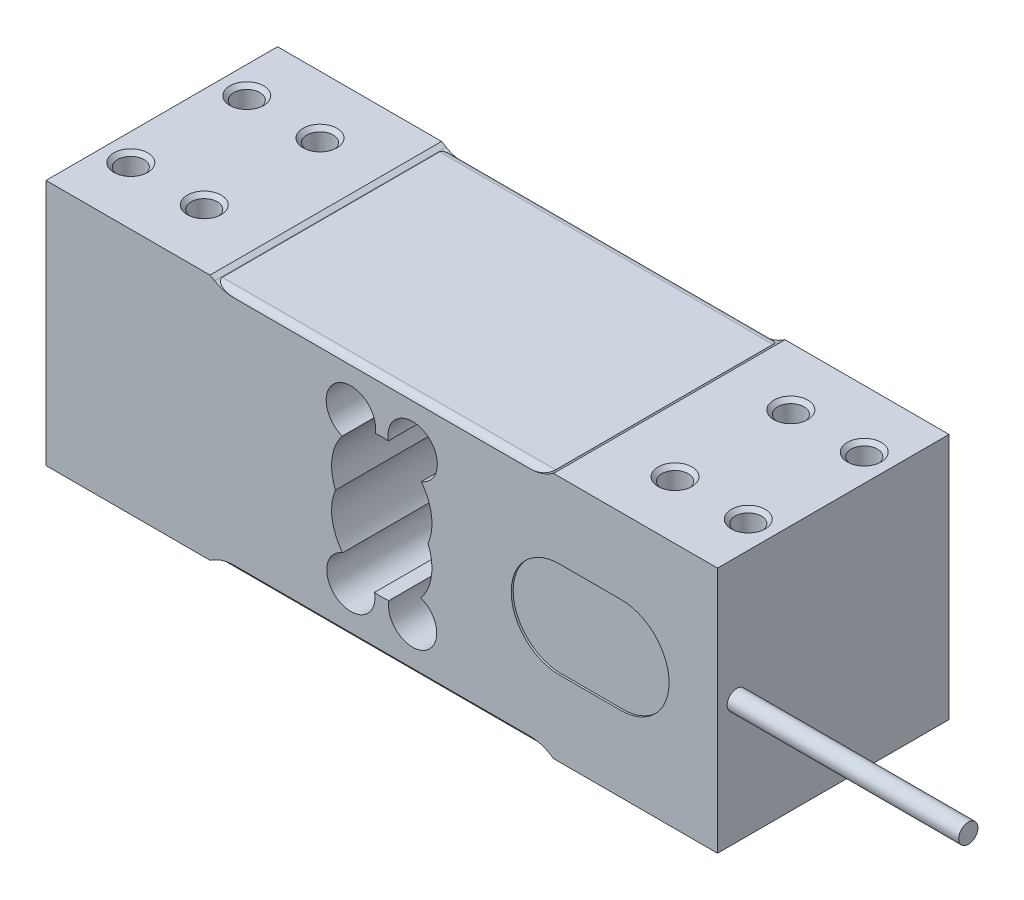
SolidWorks part; units mm, degrees
ref_plane "前视基准面" through (0, 0, 0) normal (0, 0, 1) x (1, 0, 0)
ref_plane "上视基准面" through (0, 0, 0) normal (0, 1, 0) x (1, 0, 0)
ref_plane "右视基准面" through (0, 0, 0) normal (1, 0, 0) x (0, 0, -1)
sketch "草图1" plane through (0, 0, 0) normal (0, 0, 1) x (1, 0, 0)
  line L1 (-87, 32) -> (-44.5, 32)
  line L2 (-87, 32) -> (-87, -32)
  line L3 (-87, -32) -> (-44.5, -32)
  line L4 (87, 32) -> (87, -32)
  line L8 (-44.5, 32) -> (-43.3058, 31.3176)
  line L11 (-38.3444, -30) -> (38.4089, -30)
  line L15 (-44.5, -32) -> (-43.3058, -31.3176)
  line L16 (44.5, -32) -> (43.6033, -31.4549)
  line L18 (43.6033, 31.4549) -> (44.5, 32)
  line L19 (44.5, 32) -> (87, 32)
  line L20 (44.5, -32) -> (87, -32)
  line L21 (-38.3444, 30) -> (38.4089, 30)
  arc A0 (43.6033, -31.4549) -> (38.4089, -30) centre (38.4089, -40) ccw
  arc A1 (-38.3444, -30) -> (-43.3058, -31.3176) centre (-38.3444, -40) ccw
  arc A2 (43.6033, 31.4549) -> (38.4089, 30) centre (38.4089, 40) cw
  arc A3 (-38.3444, 30) -> (-43.3058, 31.3176) centre (-38.3444, 40) cw
  arc A4 (-1.8535, -17.8672) -> (1.8535, -17.8672) centre (0, -5) ccw
  arc A5 (-10.2425, 13.0057) -> (-12, 0) centre (0, 5) ccw
  arc A6 (-1.6972, 17.8887) -> (-10.2425, 13.0057) centre (-8, 19) ccw
  arc A7 (10.2425, 13.0057) -> (1.6972, 17.8887) centre (8, 19) ccw
  arc A9 (1.8535, -17.8672) -> (10.1446, -13.1294) centre (8, -19) ccw
  arc A10 (-10.1446, -13.1294) -> (-1.8535, -17.8672) centre (-8, -19) ccw
  arc A11 (10.1446, -13.1294) -> (12, 0) centre (0, -5) ccw
  arc A13 (-12, 0) -> (-10.1446, -13.1294) centre (0, -5) ccw
  arc A14 (12, 0) -> (10.2425, 13.0057) centre (0, 5) ccw
  arc A16 (1.6972, 17.8887) -> (-1.6972, 17.8887) centre (0, 5) ccw
  point P0 (0, 0)
  point P10 (0, 0)
  point P26 (0, 0)
  point P27 (0, 0)
  point P29 (0, 0)
  dimension "D3" = 10
  dimension "D1" = 64
  dimension "D2" = 174
extrude "凸台-拉伸1" add sketch "草图1" along normal mid plane 60
sketch "草图2" plane through (0, 0, 30) normal (0, 0, 1) x (1, 0, 0)
  line L1 (-43.1856, 31.25) -> (43.2502, 31.25)
  line L3 (-43.1856, -31.25) -> (43.2502, -31.25)
  line L18 (44.5, -32) -> (87, -32)
  line L19 (87, -32) -> (87, 32)
  line L20 (87, 32) -> (44.5, 32)
  line L21 (44.5, 32) -> (43.6033, 31.4549)
  line L22 (38.4089, 30) -> (-38.3444, 30)
  line L23 (-43.3058, 31.3176) -> (-44.5, 32)
  line L24 (-44.5, 32) -> (-87, 32)
  line L25 (-87, 32) -> (-87, -32)
  line L26 (-87, -32) -> (-44.5, -32)
  line L27 (-44.5, -32) -> (-43.3058, -31.3176)
  line L28 (-38.3444, -30) -> (38.4089, -30)
  line L29 (43.6033, -31.4549) -> (44.5, -32)
  line L34 (38.4089, 30) -> (-38.3444, 30)
  line L40 (-38.3444, -30) -> (38.4089, -30)
  arc A4 (38.4089, 30) -> (43.6033, 31.4549) centre (38.4089, 40) ccw
  arc A5 (-43.3058, 31.3176) -> (-38.3444, 30) centre (-38.3444, 40) ccw
  arc A6 (-38.3444, -30) -> (-43.3058, -31.3176) centre (-38.3444, -40) ccw
  arc A7 (43.6033, -31.4549) -> (38.4089, -30) centre (38.4089, -40) ccw
  arc A8 (38.4089, 30) -> (43.2502, 31.25) centre (38.4089, 40) ccw
  arc A9 (-43.1856, 31.25) -> (-38.3444, 30) centre (-38.3444, 40) ccw
  arc A10 (-38.3444, -30) -> (-43.1856, -31.25) centre (-38.3444, -40) ccw
  arc A11 (43.2502, -31.25) -> (38.4089, -30) centre (38.4089, -40) ccw
  point P0 (0, 0)
  dimension "D1" = 0
extrude "凸台-拉伸2" add sketch "草图2" against normal blind 60 separate body
fillet "圆角1" radius 2 2 edges at (0.0323, 31.25, -30) (0.0323, 31.25, 30)
fillet "圆角2" radius 2 2 edges at (0.0323, -31.25, -30) (0.0323, -31.25, 30)
sketch "草图3" plane through (0, 0, 30) normal (0, 0, 1) x (1, 0, 0)
  line L0 (46, 0) -> (62, 0) construction
  line L1 (87, -32) -> (87, 32) construction
  line L2 (46, 12.45) -> (62, 12.45)
  line L3 (46, -12.45) -> (62, -12.45)
  arc A0 (46, 12.45) -> (46, -12.45) centre (46, 0) ccw
  arc A1 (62, -12.45) -> (62, 12.45) centre (62, 0) ccw
  point P5 (54, 0)
  dimension "D1" = 12.45
  dimension "D2" = 25
  dimension "D3" = 16
extrude "切除-拉伸1" cut sketch "草图3" against normal blind 0.5
sketch "草图4" plane through (0, 32, 0) normal (0, 1, 0) x (1, 0, 0)
  point P0 (0, 0)
  point P1 (0, 0)
  point P2 (0, 0)
  point P3 (0, 0)
  point P5 (0, 0)
  point P12 (-80, 15.0249)
  point P13 (-61, 15)
  point P14 (-80, -15.0249)
  point P15 (-61, -15)
  point P17 (61, 15)
  point P18 (80, 15.0249)
  point P19 (80, -15.0249)
  point P20 (61, -15)
sketch "草图5" plane through (0, 32, 0) normal (0, 1, 0) x (1, 0, 0)
  circle A0 centre (61, 15) radius 3.4
  circle A1 centre (80, 15.0249) radius 3.4
  circle A2 centre (61, -15) radius 3.4
  circle A3 centre (80, -15.0249) radius 3.4
extrude "切除-拉伸2" cut sketch "草图5" against normal blind 32
sketch "草图6" plane through (0, -32, 0) normal (0, -1, 0) x (1, 0, 0)
  circle A0 centre (-80, 15.0249) radius 3.4
  circle A1 centre (-61, 15) radius 3.4
  circle A2 centre (-61, -15) radius 3.4
  circle A3 centre (-80, -15.0249) radius 3.4
extrude "切除-拉伸3" cut sketch "草图6" against normal blind 32
sketch "草图7" plane through (0, -32, 0) normal (0, -1, 0) x (1, 0, 0)
  point P0 (61, 15)
  point P1 (80, 15.0249)
  point P3 (61, -15)
  point P5 (80, -15.0249)
  point P7 (0, 0)
hole_wizard "M8 螺纹孔1" positions "3D草图1" profile "草图8" tap size "M8" standard "GB"
sketch3d "3D草图1"
  point P0 (-61, 32, -15)
  point P3 (-80, 32, -15.0249)
  point P6 (-80, 32, 15.0249)
  point P9 (-61, 32, 15)
  point P12 (61, -32, 15)
  point P15 (80, -32, 15.0249)
  point P18 (80, -32, -15.0249)
  point P21 (61, -32, -15)
sketch "草图8" plane through (-61, 32, -15) normal (1, 0, 0) x (0, 0, 1)
  line L0 (0, 0) -> (0, 34.0429)
  line L1 (0, 34.0429) -> (3.4, 32)
  line L2 (3.4, 32) -> (3.4, 0)
  line L5 (3.4, 0) -> (0, 0)
  line L10 (0, 34.0429) -> (-3.4, 32) construction
  line L11 (0, -6.35) -> (0, 107.95) construction
  dimension "螺纹孔钻头直径" = 6.8
  dimension "螺纹孔钻头深度" = 32
  dimension "导头角度" = 118
chamfer "倒角1" distance 1 angle 45 16 edges at (80, -32, -18.4249) (80, -32, 11.6249) (61, -32, 11.6) (61, -32, -18.4) (-80, -32, -18.4249) (-61, -32, -18.4) (-80, -32, 11.6249) (-61, -32, 11.6) (-80, 32, 18.4249) (-61, 32, 18.4) (61, 32, 18.4) (80, 32, 18.4249) (80, 32, -11.6249) (61, 32, -11.6) (-61, 32, -11.6) (-80, 32, -11.6249)
sketch "草图9" plane through (87, 0, 0) normal (1, 0, 0) x (0, 0, -1)
  line L0 (-30, -32) -> (-30, 32) construction
  circle A0 centre (-25, 0) radius 2.5
  dimension "D1" = 5
extrude "凸台-拉伸3" add sketch "草图9" along normal blind 60
sketch "草图12" plane through (0, 0, 30) normal (0, 0, 1) x (1, 0, 0)
  line L0 (-20.7732, 105.4026) -> (217.2268, 105.4026) construction
